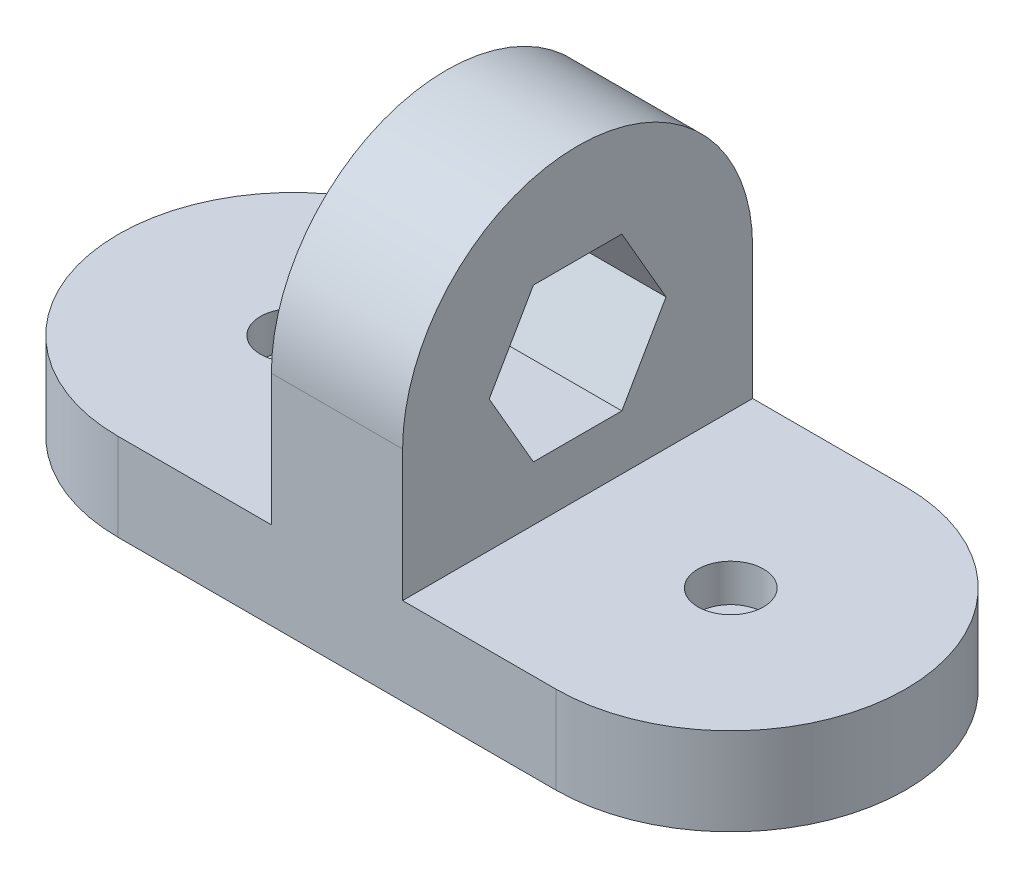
SolidWorks part; units mm, degrees
ref_plane "Ebene vorne" through (0, 0, 0) normal (0, 0, 1) x (1, 0, 0)
ref_plane "Ebene oben" through (0, 0, 0) normal (0, 1, 0) x (1, 0, 0)
ref_plane "Ebene rechts" through (0, 0, 0) normal (1, 0, 0) x (0, 0, -1)
sketch "Skizze1" plane through (0, 0, 0) normal (0, 1, 0) x (1, 0, 0)
  line L0 (-50, 0) -> (50, 0) construction
  line L1 (0, 0) -> (-50, 40) construction
  line L2 (0, 0) -> (50, -40) construction
  line L3 (-50, 0) -> (50, 0) construction
  line L4 (-50, 40) -> (50, 40)
  line L5 (-50, -40) -> (50, -40)
  arc A0 (-50, 40) -> (-50, -40) centre (-50, 0) ccw
  arc A1 (50, -40) -> (50, 40) centre (50, 0) ccw
  point P3 (0, 0)
  point P11 (0, 0)
  dimension "D1" = 50
  dimension "D2" = 50
  dimension "D3" = 40
  dimension "D4" = 40
  dimension "D6" = 50
extrude "Aufsatz-Linear austragen1" add sketch "Skizze1" along normal blind 20
hole_wizard "Stirnsenkung für M8 Zylinderschraube mit Innensechskant1" positions "3D-Skizze1" profile "Skizze2" counterbore size "M8" standard "DIN"
sketch3d "3D-Skizze1"
  line L0 (-50, 20, 0) -> (-50, 0, 0) construction
  line L1 (50, 20, 0) -> (50, 0, 0) construction
  point P0 (-50, 20, 0)
  point P4 (50, 20, 0)
sketch "Skizze2" plane through (-50, 20, 0) normal (1, 0, 0) x (0, 0, 1)
  line L0 (0, 0) -> (0, 20)
  line L1 (0, 20) -> (4.5, 20)
  line L3 (4.5, 20) -> (4.5, 8.6)
  line L4 (4.5, 8.6) -> (7.5, 8.6)
  line L5 (7.5, 8.6) -> (7.5, 0)
  line L7 (7.5, 0) -> (0, 0)
  line L11 (0, -6.35) -> (0, 107.95) construction
  dimension "Bohrerdurchmesser" = 9
  dimension "Bohrungstiefe" = 20
  dimension "Senkdurchmesser2" = 15
  dimension "Senktiefe2" = 8.6
sketch "Skizze3" plane through (0, 0, 0) normal (1, 0, 0) x (0, 0, -1)
  line L0 (-40, 20) -> (-40, 50)
  line L1 (40, 50) -> (40, 20)
  line L2 (40, 20) -> (-40, 20)
  arc A0 (-40, 50) -> (40, 50) centre (0, 50) cw
  point P4 (0, 0)
  point P5 (0, 0)
  point P9 (0, 0)
  point P11 (0, 0)
  dimension "D1" = 30
extrude "Aufsatz-Linear austragen2" add sketch "Skizze3" along normal mid plane 30
sketch "Skizze4" plane through (-15, 0, 0) normal (-1, 0, 0) x (0, 0, 1)
  line L1 (10.1036, 32.5) -> (20.2073, 50)
  line L2 (20.2073, 50) -> (10.1036, 67.5)
  line L3 (10.1036, 67.5) -> (-10.1036, 67.5)
  line L4 (-10.1036, 67.5) -> (-20.2073, 50)
  line L5 (-20.2073, 50) -> (-10.1036, 32.5)
  line L6 (-10.1036, 32.5) -> (10.1036, 32.5)
  line L8 (40, 20) -> (-40, 20) construction
  circle A0 centre (0, 50) radius 17.5 construction
  dimension "D1" = 35
extrude "Schnitt-Linear austragen1" cut sketch "Skizze4" against normal through all
